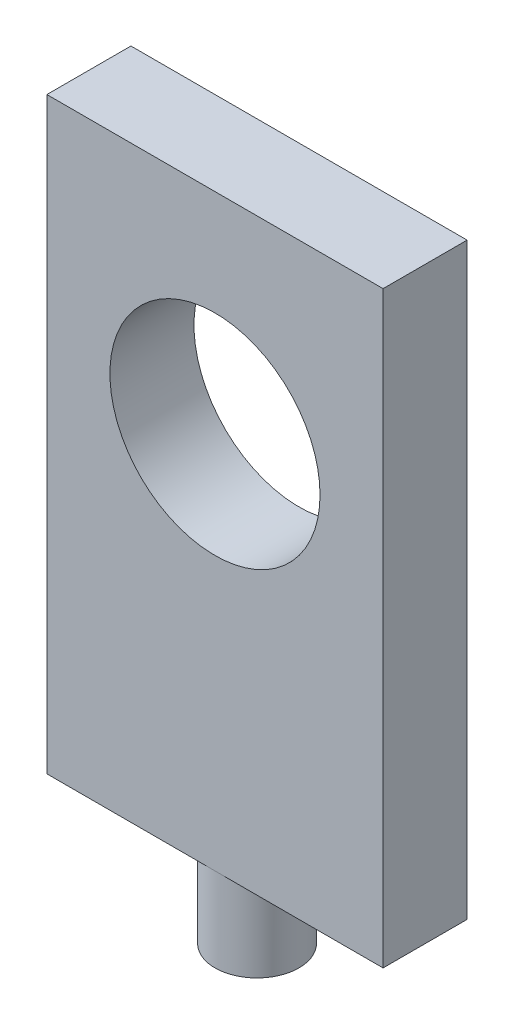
SolidWorks part; units mm, degrees
ref_plane "Plan de face" through (0, 0, 0) normal (0, 0, 1) x (1, 0, 0)
ref_plane "Plan de dessus" through (0, 0, 0) normal (0, 1, 0) x (1, 0, 0)
ref_plane "Plan de droite" through (0, 0, 0) normal (1, 0, 0) x (0, 0, -1)
sketch "Esquisse1" plane through (0, 0, 0) normal (0, 0, 1) x (1, 0, 0)
  line L1 (0, 0) -> (40, 0)
  line L2 (0, 0) -> (0, 70)
  line L3 (0, 70) -> (40, 70)
  line L4 (40, 0) -> (40, 70)
  dimension "D1" = 40
  dimension "D2" = 70
extrude "Boss.-Extru.1" add sketch "Esquisse1" along normal blind 10
sketch "Esquisse2" plane through (0, 0, 10) normal (0, 0, 1) x (1, 0, 0)
  line L0 (0, 0) -> (40, 0) construction
  line L1 (40, 0) -> (40, 70) construction
  circle A0 centre (20, 45) radius 12.5
  dimension "D2" = 25
  dimension "D1" = 45
  dimension "D3" = 20
extrude "Enlèv. mat.-Extru.1" cut sketch "Esquisse2" against normal through all
sketch "Esquisse3" plane through (0, 0, 0) normal (0, -1, 0) x (1, 0, 0)
  line L0 (-6.8292, 5) -> (48.12, 5) construction
  line L1 (20, 13.9553) -> (20, -9.647) construction
  circle A0 centre (20, 5) radius 5
extrude "Boss.-Extru.2" add sketch "Esquisse3" along normal blind 10
